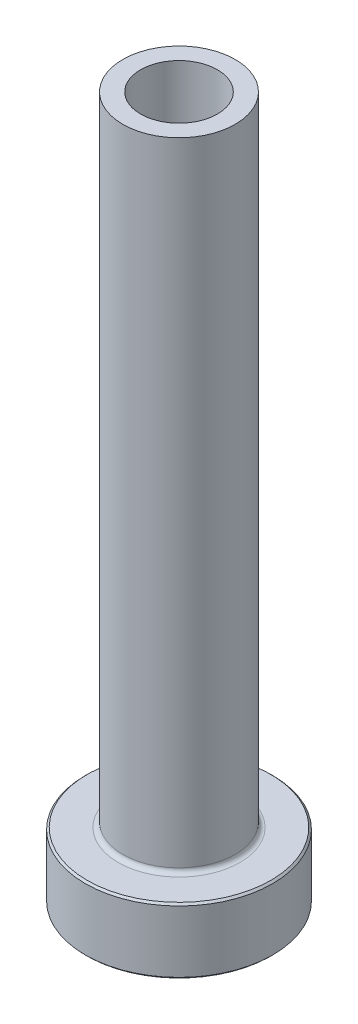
SolidWorks part; units mm, degrees
ref_plane "Front Plane" through (0, 0, 0) normal (0, 0, 1) x (1, 0, 0)
ref_plane "Top Plane" through (0, 0, 0) normal (0, 1, 0) x (1, 0, 0)
ref_plane "Right Plane" through (0, 0, 0) normal (1, 0, 0) x (0, 0, -1)
sketch "Sketch1" plane through (0, 0, 0) normal (0, 0, 1) x (1, 0, 0)
  line L0 (-4.1, 75) -> (-6, 75)
  line L1 (-6, 75) -> (-6, 7)
  line L2 (-6, 7) -> (-10, 7)
  line L3 (-10, 7) -> (-10, 0)
  line L4 (11, 0) -> (-11, 0) construction
  line L5 (-10, 0) -> (-4.35, 0)
  line L6 (-4.1, 30) -> (-4.1, 75)
  line L7 (0, 92.1877) -> (0, -15.5353) construction
  line L8 (0, -11) -> (0, 11) construction
  line L9 (-4.1, 30) -> (-4.35, 18)
  line L10 (-4.35, 18) -> (-4.35, 0)
  dimension "D1" = 0.25
  dimension "ID" = 8.2
  dimension "OD" = 12
  dimension "L" = 75
  dimension "H" = 20
  dimension "T" = 7
  dimension "N" = 45
  dimension "D2" = 12
revolve "Revolve1" add sketch "Sketch1" angle 360 about L7
fillet "Fillet1" radius 0.5 1 edges at (0, 7, 6)
chamfer "Chamfer1" distance 0.2 angle 45 2 edges at (0, 7, 10) (0, 0, 10)
chamfer "Chamfer3" distance 0.5 angle 45 1 edges at (0, 0, 4.35)
